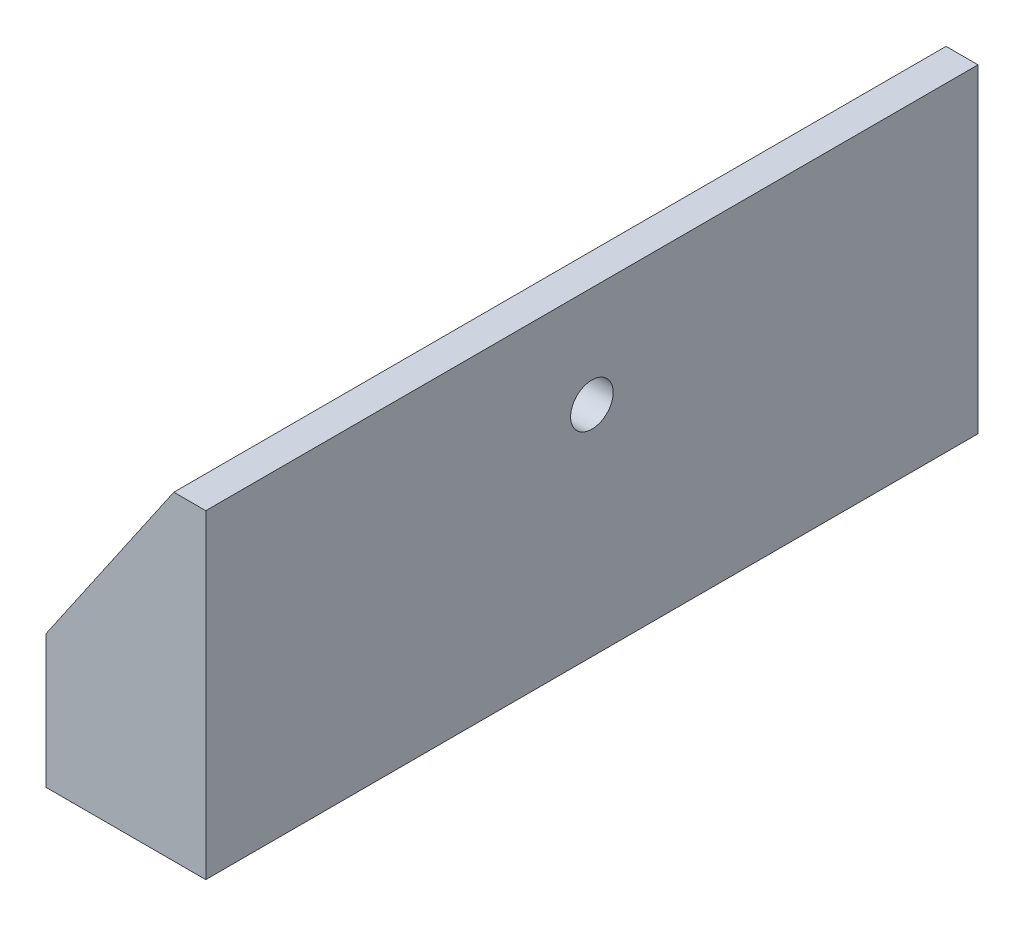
SolidWorks part; units mm, degrees
ref_plane "Plan de face" through (0, 0, 0) normal (0, 0, 1) x (1, 0, 0)
ref_plane "Plan de dessus" through (0, 0, 0) normal (0, 1, 0) x (1, 0, 0)
ref_plane "Plan de droite" through (0, 0, 0) normal (1, 0, 0) x (0, 0, -1)
ref_plane "Plan1" through (0, 0, 36.25) normal (0, 0, 1) x (1, 0, 0)
sketch "Esquisse1" plane through (0, 0, 36.25) normal (0, 0, 1) x (1, 0, 0)
  line L0 (7.5, -15) -> (7.5, 15)
  line L1 (7.5, 15) -> (4.5, 15)
  line L2 (4.5, 15) -> (-7.5, -2.5)
  line L3 (-7.5, -2.5) -> (-7.5, -15)
  line L4 (-7.5, -15) -> (7.5, -15)
extrude "Boss.-Extru.1" add sketch "Esquisse1" against normal blind 72.5
sketch "Esquisse2" plane through (7.5, 0, 0) normal (1, 0, 0) x (0, 0, -1)
  line L0 (36.25, 15) -> (-36.25, 15) construction
  line L1 (36.25, -15) -> (36.25, 15) construction
  line L2 (-36.25, -15) -> (-36.25, 15) construction
  circle A0 centre (0, 5.5) radius 2
  dimension "D1" = 4
  dimension "D3" = 72.5
  dimension "D4" = 36.25
  dimension "D2" = 9.5
extrude "Enlèv. mat.-Extru.1" cut sketch "Esquisse2" against normal through all
sketch "Esquisse3" plane through (7.5, 0, 0) normal (1, 0, 0) x (0, 0, -1)
  line L0 (0, 3.5) -> (0, 7.5)
  circle A0 centre (0, 5.5) radius 2 construction
